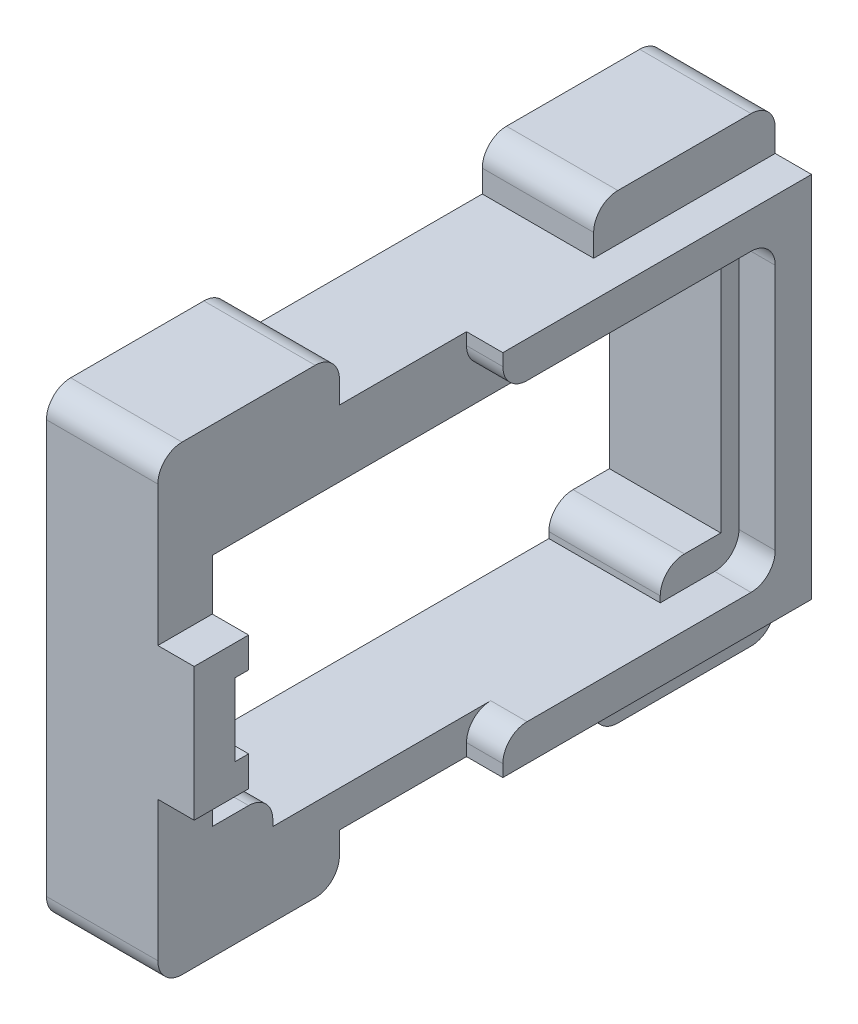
SolidWorks part; units mm, degrees
ref_plane "Front Plane" through (0, 0, 0) normal (0, 0, 1) x (1, 0, 0)
ref_plane "Top Plane" through (0, 0, 0) normal (0, 1, 0) x (1, 0, 0)
ref_plane "Right Plane" through (0, 0, 0) normal (1, 0, 0) x (0, 0, -1)
inserted part "params_print"
sketch "Body" plane through (0, 0, 0) normal (1, 0, 0) x (0, 0, -1)
  line L0 (-22.5, 0) -> (22.5, 0) construction
  line L1 (-22.5, -12.2) -> (22.5, -12.2) construction
  line L2 (-22.5, -12.2) -> (-22.5, 12.2) construction
  line L3 (-22.5, 12.2) -> (22.5, 12.2) construction
  line L4 (22.5, -12.2) -> (22.5, 12.2) construction
  line L5 (-22.5, -12.2) -> (22.5, 12.2) construction
  line L6 (-22.5, 12.2) -> (22.5, -12.2) construction
  line L7 (-25.5, 15.2) -> (25.5, 15.2)
  line L8 (25.5, -15.2) -> (25.5, 15.2)
  line L9 (-25.5, -15.2) -> (25.5, -15.2)
  line L10 (-25.5, -15.2) -> (-25.5, 15.2)
  line L11 (-21, 9.7) -> (21, 9.7)
  line L12 (21, -9.7) -> (21, 9.7)
  line L13 (-21, -9.7) -> (21, -9.7)
  line L14 (-21, -9.7) -> (-21, 9.7)
  line L15 (0, 0) -> (0, 15.2) construction
  circle A0 centre (-12.5, 0) radius 8.5 construction
  point P0 (0, 0)
  dimension "D4" = 17
  dimension "D1" = 2.5
  dimension "DynWidth" = 24.4
  dimension "DynHeight" = 45
  dimension "D3" = 10
  dimension "D5" = 3
extrude "Main Body" add sketch "Body" along normal mid plane 8
sketch "Sketch3" plane through (4, 0, 0) normal (1, 0, 0) x (0, 0, -1)
  line L0 (-22.5, 0) -> (22.5, 0) construction
  line L1 (-22.5, -12.2) -> (22.5, -12.2) construction
  line L2 (-22.5, -12.2) -> (-22.5, 12.2) construction
  line L3 (-22.5, 12.2) -> (22.5, 12.2) construction
  line L4 (22.5, -12.2) -> (22.5, 12.2) construction
  line L5 (-22.5, -12.2) -> (22.5, 12.2) construction
  line L6 (-22.5, 12.2) -> (22.5, -12.2) construction
  line L7 (-25.5, 5.5) -> (-25.5, -5.5)
  line L8 (-25.5, 15.2) -> (-25.5, -15.2) construction
  line L9 (-25.5, -5.5) -> (-21, -5.5)
  line L10 (-21, -5.5) -> (-21, -3)
  line L11 (-25.5, 5.5) -> (-21, 5.5)
  line L12 (-21, 5.5) -> (-21, 3)
  line L13 (-21, 3) -> (-22.125, 3)
  line L14 (-22.125, 3) -> (-22.125, -3)
  line L15 (-22.125, -3) -> (-21, -3)
  line L16 (-21, 9.7) -> (-21, -9.7) construction
  line L17 (0, 15.2) -> (0, 12.2)
  line L18 (25.5, 15.2) -> (-25.5, 15.2) construction
  line L19 (0, 12.2) -> (22.5, 12.2)
  line L20 (22.5, 12.2) -> (22.5, -12.2)
  line L21 (22.5, -12.2) -> (0, -12.2)
  line L22 (0, -12.2) -> (0, -15.2)
  line L23 (-25.5, -15.2) -> (25.5, -15.2) construction
  line L24 (0, -15.2) -> (25.5, -15.2)
  line L25 (25.5, -15.2) -> (25.5, 15.2)
  line L26 (25.5, 15.2) -> (0, 15.2)
  point P0 (0, 0)
  dimension "D1" = 45
  dimension "D2" = 24.4
  dimension "D3" = 0.75
  dimension "D4" = 11
  dimension "D5" = 6
extrude "Clamp Walls" add sketch "Sketch3" along normal blind 3
sketch "Sketch4" plane through (-4, 0, 0) normal (-1, 0, 0) x (0, 0, 1)
  line L0 (0, 15.2) -> (0, -15.2) construction
  line L1 (-25.5, 15.2) -> (25.5, 15.2) construction
  line L2 (25.5, -15.2) -> (-25.5, -15.2) construction
  line L3 (25.5, -15.2) -> (10.5, -15.2)
  line L4 (-25.5, 15.2) -> (-10.5, 15.2)
  line L5 (-25.5, 15.2) -> (-25.5, 19.05)
  line L6 (-25.5, 19.05) -> (-10.5, 19.05)
  line L7 (-10.5, 15.2) -> (-10.5, 19.05)
  line L8 (-25.5, -15.2) -> (-10.5, -15.2)
  line L9 (-25.5, -15.2) -> (-25.5, -19.05)
  line L10 (-25.5, -19.05) -> (-10.5, -19.05)
  line L11 (-10.5, -15.2) -> (-10.5, -19.05)
  line L12 (25.5, -15.2) -> (25.5, -19.05)
  line L13 (25.5, -19.05) -> (10.5, -19.05)
  line L14 (10.5, -15.2) -> (10.5, -19.05)
  line L15 (25.5, 15.2) -> (10.5, 15.2)
  line L16 (25.5, 15.2) -> (25.5, 19.05)
  line L17 (25.5, 19.05) -> (10.5, 19.05)
  line L18 (10.5, 15.2) -> (10.5, 19.05)
  dimension "D1" = 15
  dimension "D2" = 3.85
  dimension "D3" = 3.85
extrude "Standoffs" add sketch "Sketch4" against normal up to surface (8 mm away)
sketch "Sketch5" plane through (4, 0, 0) normal (1, 0, 0) x (0, 0, -1)
  line L0 (22.5, -12.2) -> (0, -12.2) construction
  line L1 (16, -12.2) -> (-16, -12.2)
  line L2 (16, -12.2) -> (16, -9.7)
  line L3 (16, -9.7) -> (-16, -9.7)
  line L4 (-16, -12.2) -> (-16, -9.7)
  line L5 (-21, -9.7) -> (21, -9.7) construction
  line L6 (0, 0) -> (0, 9.7) construction
  line L7 (21, 9.7) -> (-21, 9.7) construction
  dimension "D1" = 5
extrude "Clearance - MX Capacitor" cut sketch "Sketch5" against normal through all
fillet "Contouring" radius 2 14 edges at (5.5, -12.2, -22.5) (5.5, -12.2, 0) (5.5, 12.2, -22.5) (5.5, 12.2, 0) (0, 19.05, -25.5) (0, 19.05, -10.5) (0, 19.05, 25.5) (0, 19.05, 10.5) (0, -19.05, -25.5) (0, -19.05, -10.5) (0, -19.05, 25.5) (0, -19.05, 10.5) (0, -9.7, 16) (0, -9.7, -16)
sketch "Sketch6" plane through (-4, 0, 0) normal (-1, 0, 0) x (0, 0, 1)
  line L8 (18, -9.7) -> (21, -9.7)
  line L9 (16, -12.2) -> (16, -11.7)
  line L10 (-16, -12.2) -> (16, -12.2)
  line L11 (-16, -11.7) -> (-16, -12.2)
  line L12 (-12.5, 19.05) -> (-23.5, 19.05)
  line L13 (-25.5, 17.05) -> (-25.5, -17.05)
  line L14 (-23.5, -19.05) -> (-12.5, -19.05)
  line L15 (-10.5, -17.05) -> (-10.5, -15.2)
  line L16 (-10.5, -15.2) -> (10.5, -15.2)
  line L17 (10.5, -15.2) -> (10.5, -17.05)
  line L18 (12.5, -19.05) -> (23.5, -19.05)
  line L19 (25.5, -17.05) -> (25.5, 17.05)
  line L20 (23.5, 19.05) -> (12.5, 19.05)
  line L21 (10.5, 17.05) -> (10.5, 15.2)
  line L22 (10.5, 15.2) -> (-10.5, 15.2)
  line L23 (-10.5, 15.2) -> (-10.5, 17.05)
  line L24 (-12.5, 19.05) -> (-23.5, 19.05)
  line L25 (-25.5, 17.05) -> (-25.5, -17.05)
  line L26 (-23.5, -19.05) -> (-12.5, -19.05)
  line L27 (-10.5, -17.05) -> (-10.5, -15.2)
  line L28 (-10.5, -15.2) -> (10.5, -15.2)
  line L29 (10.5, -15.2) -> (10.5, -17.05)
  line L30 (12.5, -19.05) -> (23.5, -19.05)
  line L31 (25.5, -17.05) -> (25.5, 17.05)
  line L32 (23.5, 19.05) -> (12.5, 19.05)
  line L33 (10.5, 17.05) -> (10.5, 15.2)
  line L34 (10.5, 15.2) -> (-10.5, 15.2)
  line L35 (-10.5, 15.2) -> (-10.5, 17.05)
  line L36 (-21, -9.7) -> (-18, -9.7)
  line L37 (-21, 9.7) -> (-21, -9.7)
  line L38 (21, 9.7) -> (-21, 9.7)
  line L39 (21, -9.7) -> (21, 9.7)
  line L40 (18, -9.7) -> (21, -9.7)
  line L41 (16, -12.2) -> (16, -11.7)
  line L42 (-16, -12.2) -> (16, -12.2)
  line L43 (-16, -11.7) -> (-16, -12.2)
  line L44 (-21, -9.7) -> (-18, -9.7)
  line L45 (-21, 9.7) -> (-21, -9.7)
  line L46 (21, 9.7) -> (-21, 9.7)
  line L47 (21, -9.7) -> (21, 9.7)
  arc A2 (18, -9.7) -> (16, -11.7) centre (18, -11.7) ccw
  arc A3 (-16, -11.7) -> (-18, -9.7) centre (-18, -11.7) ccw
  arc A4 (18, -9.7) -> (16, -11.7) centre (18, -11.7) ccw
  arc A5 (-16, -11.7) -> (-18, -9.7) centre (-18, -11.7) ccw
  arc A8 (-23.5, 19.05) -> (-25.5, 17.05) centre (-23.5, 17.05) ccw
  arc A9 (-25.5, -17.05) -> (-23.5, -19.05) centre (-23.5, -17.05) ccw
  arc A10 (-12.5, -19.05) -> (-10.5, -17.05) centre (-12.5, -17.05) ccw
  arc A11 (10.5, -17.05) -> (12.5, -19.05) centre (12.5, -17.05) ccw
  arc A12 (23.5, -19.05) -> (25.5, -17.05) centre (23.5, -17.05) ccw
  arc A13 (25.5, 17.05) -> (23.5, 19.05) centre (23.5, 17.05) ccw
  arc A14 (12.5, 19.05) -> (10.5, 17.05) centre (12.5, 17.05) ccw
  arc A15 (-10.5, 17.05) -> (-12.5, 19.05) centre (-12.5, 17.05) ccw
  arc A16 (-23.5, 19.05) -> (-25.5, 17.05) centre (-23.5, 17.05) ccw
  arc A17 (-25.5, -17.05) -> (-23.5, -19.05) centre (-23.5, -17.05) ccw
  arc A18 (-12.5, -19.05) -> (-10.5, -17.05) centre (-12.5, -17.05) ccw
  arc A19 (10.5, -17.05) -> (12.5, -19.05) centre (12.5, -17.05) ccw
  arc A20 (23.5, -19.05) -> (25.5, -17.05) centre (23.5, -17.05) ccw
  arc A21 (25.5, 17.05) -> (23.5, 19.05) centre (23.5, 17.05) ccw
  arc A22 (12.5, 19.05) -> (10.5, 17.05) centre (12.5, 17.05) ccw
  arc A23 (-10.5, 17.05) -> (-12.5, 19.05) centre (-12.5, 17.05) ccw
  dimension "D1" = 0
  dimension "D2" = 0
extrude "Boss-Extrude1" add sketch "Sketch6" along normal blind 1.2
ref_point "Point1"
equation "\"D5@Body\"=\"width keep@values@params_print.SLDPRT\""
equation "\"D1@Sketch3\"=\"DynHeight@Body\""
equation "\"D2@Sketch3\"=\"DynWidth@Body\""
equation "\"D1@Clamp Walls\"=\"width keep@values@params_print.SLDPRT\""
equation "\"D2@Sketch4\"=5.6+1.25-\"width keep@values@params_print.SLDPRT\""
equation "\"D3@Sketch4\"=5.6+1.25-\"width keep@values@params_print.SLDPRT\""
